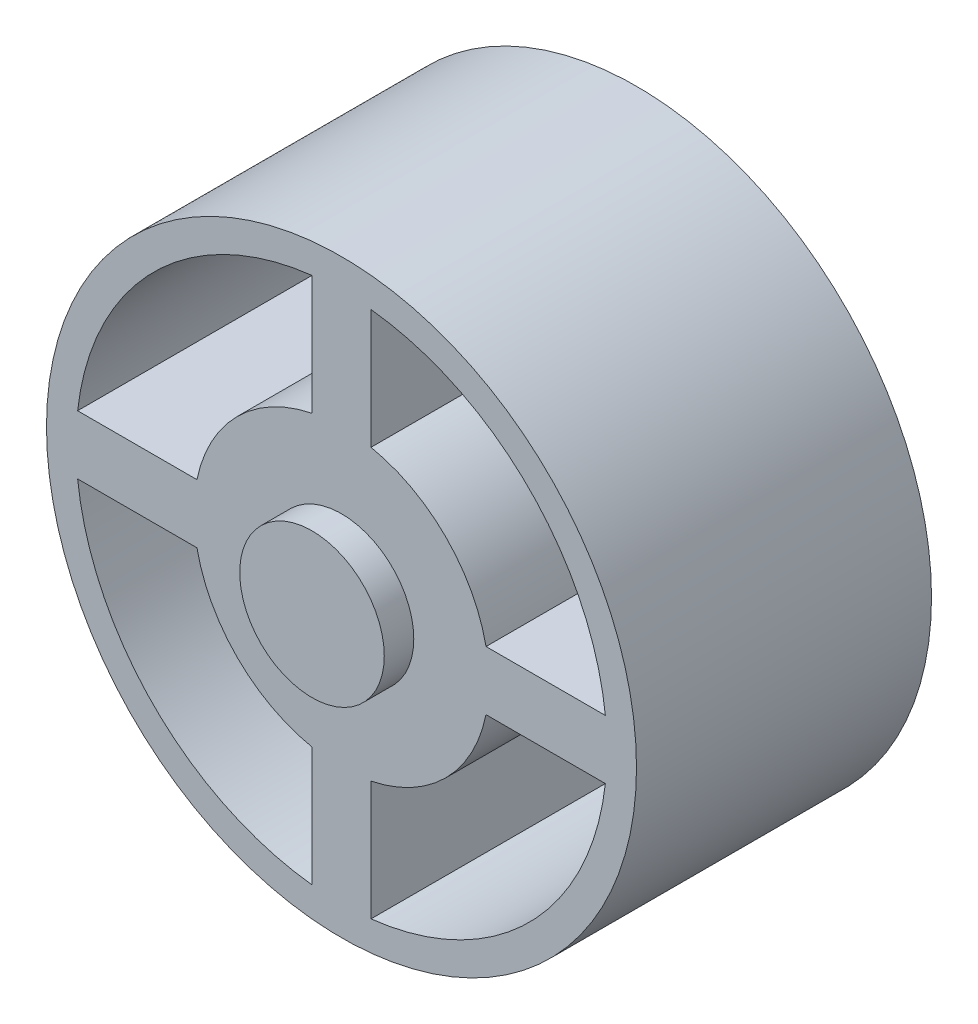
SolidWorks part; units mm, degrees
ref_plane "Front Plane" through (0, 0, 0) normal (0, 0, 1) x (1, 0, 0)
ref_plane "Top Plane" through (0, 0, 0) normal (0, 1, 0) x (1, 0, 0)
ref_plane "Right Plane" through (0, 0, 0) normal (1, 0, 0) x (0, 0, -1)
sketch "Sketch1" plane through (0, 0, 0) normal (0, 0, 1) x (1, 0, 0)
  line L6 (-10, 89.4427) -> (-10, 48.9898)
  line L7 (10, 89.4427) -> (10, 48.9898)
  line L8 (89.4427, 10) -> (48.9898, 10)
  line L9 (89.4427, -10) -> (48.9898, -10)
  line L10 (10, -89.4427) -> (10, -48.9898)
  line L11 (-10, -89.4427) -> (-10, -48.9898)
  line L12 (-89.4427, -10) -> (-48.9898, -10)
  line L13 (-89.4427, 10) -> (-48.9898, 10)
  circle A0 centre (0, 0) radius 100
  arc A2 (-10, 48.9898) -> (-48.9898, 10) centre (0, 0) ccw
  arc A3 (-10, 89.4427) -> (-89.4427, 10) centre (0, 0) ccw
  circle A5 centre (0, 0) radius 90 construction
  arc A9 (-89.4427, -10) -> (-10, -89.4427) centre (0, 0) ccw
  arc A10 (-48.9898, -10) -> (-10, -48.9898) centre (0, 0) ccw
  arc A11 (10, -48.9898) -> (48.9898, -10) centre (0, 0) ccw
  arc A12 (10, -89.4427) -> (89.4427, -10) centre (0, 0) ccw
  arc A13 (89.4427, 10) -> (10, 89.4427) centre (0, 0) ccw
  arc A14 (48.9898, 10) -> (10, 48.9898) centre (0, 0) ccw
  point P38 (0, 0)
  dimension "D1" = 200
  dimension "D5" = 20
  dimension "D4" = 10
  dimension "D7" = 4
extrude "Boss-Extrude1" add sketch "Sketch1" along normal blind 100
sketch "Sketch2" plane through (0, 0, 100) normal (0, 0, 1) x (1, 0, 0)
  circle A0 centre (0, 0) radius 24.5
  dimension "D1" = 49
extrude "Boss-Extrude2" add sketch "Sketch2" along normal blind 10 and the other way blind 110
